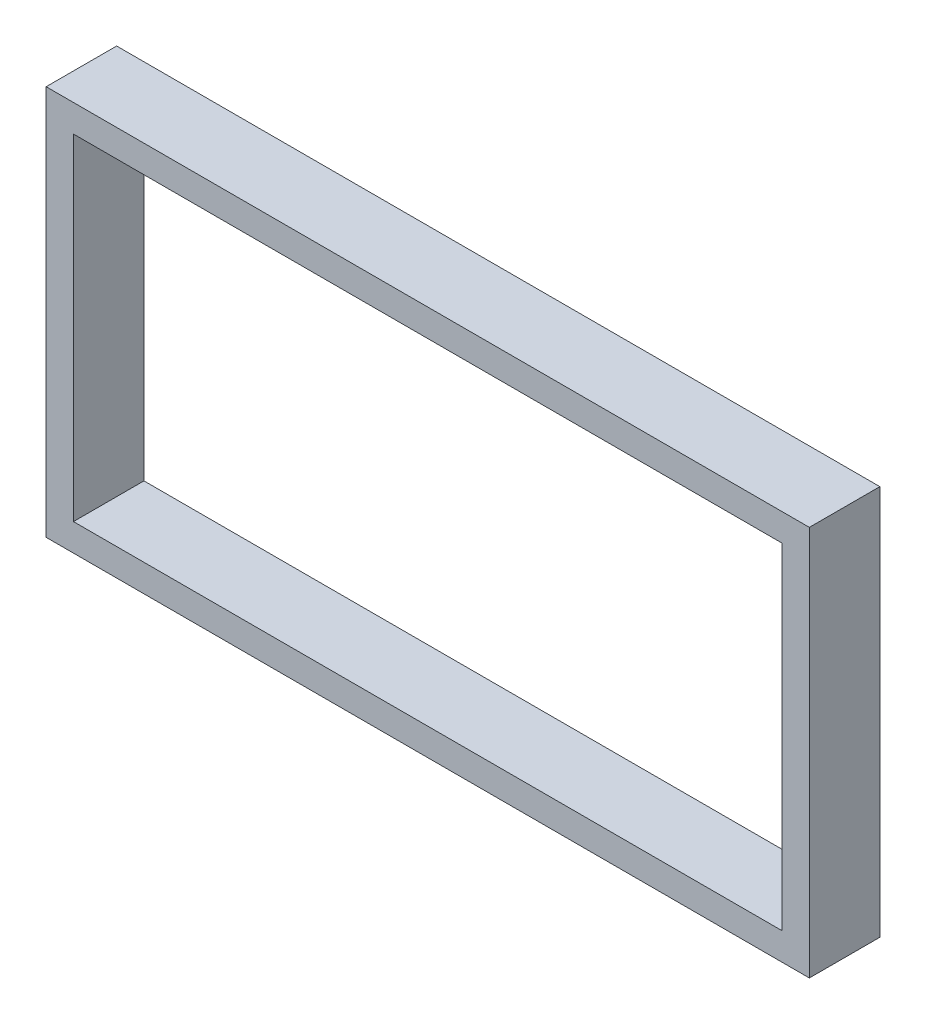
SolidWorks part; units mm, degrees
ref_plane "Front Plane" through (0, 0, 0) normal (0, 0, 1) x (1, 0, 0)
ref_plane "Top Plane" through (0, 0, 0) normal (0, 1, 0) x (1, 0, 0)
ref_plane "Right Plane" through (0, 0, 0) normal (1, 0, 0) x (0, 0, -1)
sketch "Sketch1" plane through (0, 0, 0) normal (0, 0, 1) x (1, 0, 0)
  line L1 (-55.88, 28.575) -> (55.88, 28.575)
  line L2 (-55.88, 28.575) -> (-55.88, -28.575)
  line L3 (-55.88, -28.575) -> (55.88, -28.575)
  line L4 (55.88, 28.575) -> (55.88, -28.575)
  line L5 (-55.88, 28.575) -> (55.88, -28.575) construction
  line L6 (-55.88, -28.575) -> (55.88, 28.575) construction
  point P0 (0, 0)
  dimension "D1" = 57.15
  dimension "D2" = 111.76
extrude "Boss-Extrude1" add sketch "Sketch1" along normal blind 10.3251
sketch "Sketch2" plane through (0, 0, 10.3251) normal (0, 0, 1) x (1, 0, 0)
  line L0 (-55.88, 28.575) -> (-55.88, -28.575) construction
  line L1 (-51.88, 24.575) -> (51.88, 24.575)
  line L2 (-51.88, 24.575) -> (-51.88, -24.575)
  line L3 (-51.88, -24.575) -> (51.88, -24.575)
  line L4 (51.88, 24.575) -> (51.88, -24.575)
  line L5 (-51.88, 24.575) -> (51.88, -24.575) construction
  line L6 (-51.88, -24.575) -> (51.88, 24.575) construction
  line L7 (55.88, 28.575) -> (-55.88, 28.575) construction
  point P0 (0, 0)
  dimension "D1" = 4
  dimension "D2" = 4
extrude "Cut-Extrude1" cut sketch "Sketch2" against normal through all
